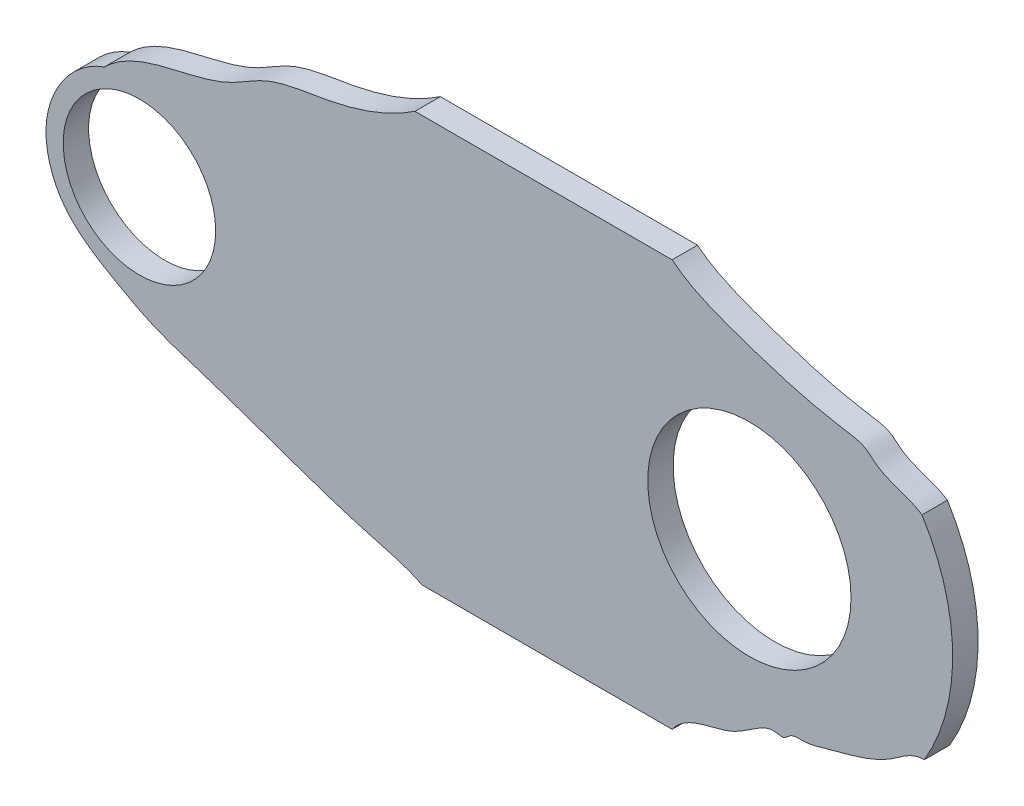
SolidWorks part; units mm, degrees
ref_plane "Front Plane" through (0, 0, 0) normal (0, 0, 1) x (1, 0, 0)
ref_plane "Top Plane" through (0, 0, 0) normal (0, 1, 0) x (1, 0, 0)
ref_plane "Right Plane" through (0, 0, 0) normal (1, 0, 0) x (0, 0, -1)
sketch "Sketch1" plane through (0, 0, 0) normal (0, 0, 1) x (1, 0, 0)
  line L0 (0, 0) -> (76.2, 0)
  line L1 (0, -50.8) -> (76.2, -50.8)
  arc A0 (0, 0) -> (0, -50.8) centre (0, -25.4) ccw
  arc A1 (76.2, -50.8) -> (76.2, 0) centre (76.2, -25.4) ccw
  circle A2 centre (0, -25.4) radius 9.525
  circle A3 centre (76.2, -25.4) radius 12.7
extrude "Boss-Extrude1" add sketch "Sketch1" along normal mid plane 3.175
sketch "Sketch2" plane through (0, 0, 1.5875) normal (0, 0, 1) x (1, 0, 0)
  line L0 (76.2, 0) -> (0, 0) construction
  line L1 (0, -50.8) -> (76.2, -50.8) construction
  line L2 (34.421, 0) -> (0, 0)
  line L3 (35.3528, -50.8) -> (0, -50.8)
  line L4 (66.5515, 0) -> (76.2, 0)
  line L5 (66.5515, -50.8) -> (76.2, -50.8)
  arc A0 (76.2, -50.8) -> (76.2, 0) centre (76.2, -25.4) ccw construction
  arc A1 (0, 0) -> (0, -50.8) centre (0, -25.4) ccw
  arc A3 (76.2, 0) -> (97.77, -11.9876) centre (76.2, -25.4) cw
  arc A4 (76.2, -50.8) -> (98.0566, -38.3402) centre (76.2, -25.4) ccw
  spline S0 degree 3 poles (34.421, 0) (31.1068, -2.238) (24.7837, -4.3916) (16.3726, -5.1676) (8.0871, -11.0509) (-0.0219, -10.2876) (-4.3758, -14.592) knots 0 0 0 0 0.285025 0.477252 0.592182 1 1 1 1
  spline S1 degree 3 poles (-4.3758, -14.592) (-8.4885, -16.0672) (-13.1576, -22.7674) (-10.0792, -32.9254) (-3.7775, -36.6878) (1.9661, -39.8241) (9.0494, -41.9679) (17.6036, -44.9974) (26.8294, -48.2819) (32.8571, -49.6068) (35.3528, -50.8) knots 0 0 0 0 0.186565 0.294462 0.418873 0.489089 0.577914 0.735962 0.881002 1 1 1 1
  spline S2 degree 3 poles (66.5515, -50.8) (68.3851, -48.2067) (72.799, -48.4343) (76.652, -45.6695) (78.8215, -44.3415) (80.5475, -44.9271) (81.4613, -43.7424) (83.3052, -44.0107) (85.9905, -43.1695) (89.7403, -42.2796) (94.0484, -40.5987) (96.4612, -38.3131) (98.0566, -38.3402) knots 0 0 0 0 0.243553 0.339654 0.417853 0.450838 0.478711 0.531667 0.597471 0.726484 0.867337 1 1 1 1
  spline S3 degree 3 poles (66.5515, 0) (68.219, -1.3842) (71.7164, -2.9804) (77.3466, -4.9234) (82.628, -6.5817) (87.2573, -7.5069) (90.453, -7.9306) (93.0568, -10.514) (95.9891, -10.7828) (97.77, -11.9876) knots 0 0 0 0 0.191375 0.338945 0.531515 0.680444 0.766415 0.804102 1 1 1 1
extrude "Cut-Extrude1" cut sketch "Sketch2" against normal up to next contours A1 L3 S1 S0 L2 | A3 S3 L4 | A4 S2 L5
equation "\"Width\"= 2"
equation "\"CenterSpacing\"= 3.000in"
equation "\"T\"= 0.1250in"
equation "\"BracketHole\"= 0.750in"
equation "\"OtherHole\"= 1.000in"
equation "\"Length\"= \"CenterSpacing\" + \"Width\""
equation "\"EndOffset\"= \"Width\" / 2"
equation "\"D3@Sketch1\"=\"Width\""
equation "\"D1@Sketch1\"=\"CenterSpacing\""
equation "\"D2@Sketch1\"=\"BracketHole\""
equation "\"D4@Sketch1\"=\"OtherHole\""
equation "\"D1@Boss-Extrude1\"=\"T\""
